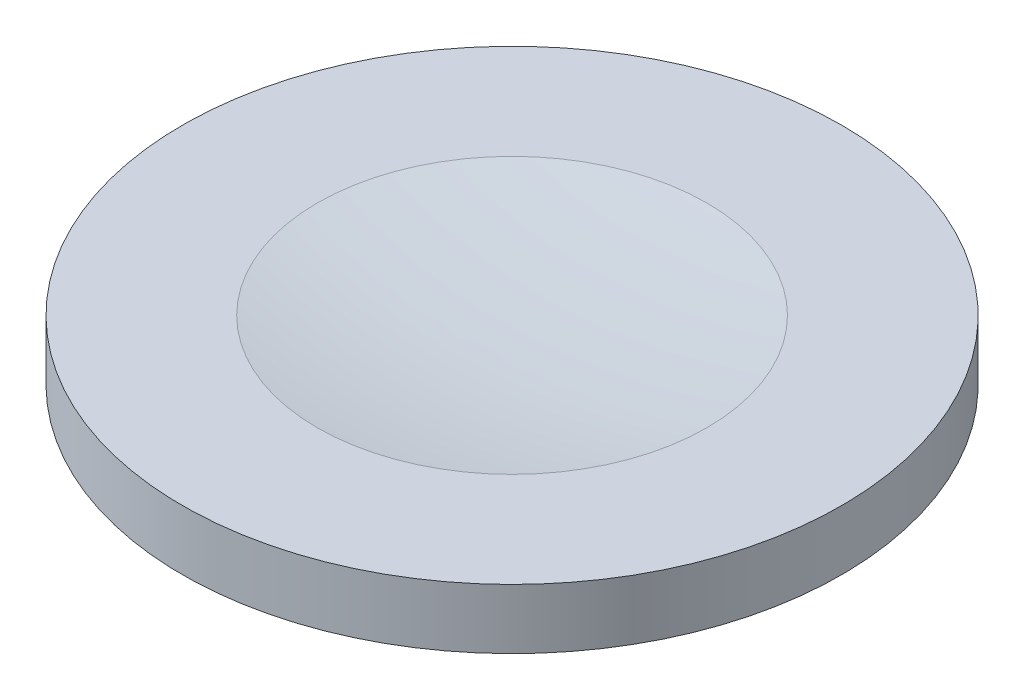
SolidWorks part; units mm, degrees
ref_plane "Plan de face" through (0, 0, 0) normal (0, 0, 1) x (1, 0, 0)
ref_plane "Plan de dessus" through (0, 0, 0) normal (0, 1, 0) x (1, 0, 0)
ref_plane "Plan de droite" through (0, 0, 0) normal (1, 0, 0) x (0, 0, -1)
sketch "Esquisse1" plane through (0, 0, 0) normal (0, 0, 1) x (1, 0, 0)
  line L0 (0, 0) -> (0, 5) construction
  line L1 (-3, 3) -> (0, 3)
  line L2 (-6.5, 5.5) -> (-11, 5.5)
  line L3 (-11, 5.5) -> (-11, 3.5)
  line L4 (-11, 3.5) -> (-5.5, 3.5)
  line L5 (-5.5, 3.5) -> (-5.5, 3)
  line L6 (-5.5, 3) -> (-4, 3)
  line L7 (-4, 3) -> (-4, 0)
  line L8 (-4, 0) -> (-3, 0)
  line L9 (-3, 0) -> (-3, 3)
  line L10 (0, 3) -> (0, 5)
  line L11 (0, 5) -> (-11, 5) construction
  line L12 (0, 5.5) -> (0, 15.2766) construction
  arc A0 (-6.5, 5.5) -> (0, 5) centre (0, 47.5) ccw
  dimension "D1" = 22
  dimension "D2" = 11
  dimension "D3" = 8
  dimension "D4" = 1
  dimension "D5" = 5.5
  dimension "D6" = 2
  dimension "D7" = 0.5
  dimension "D8" = 13
  dimension "D9" = 0.5
revolve "Révolution1" add sketch "Esquisse1" angle 360 about L12
